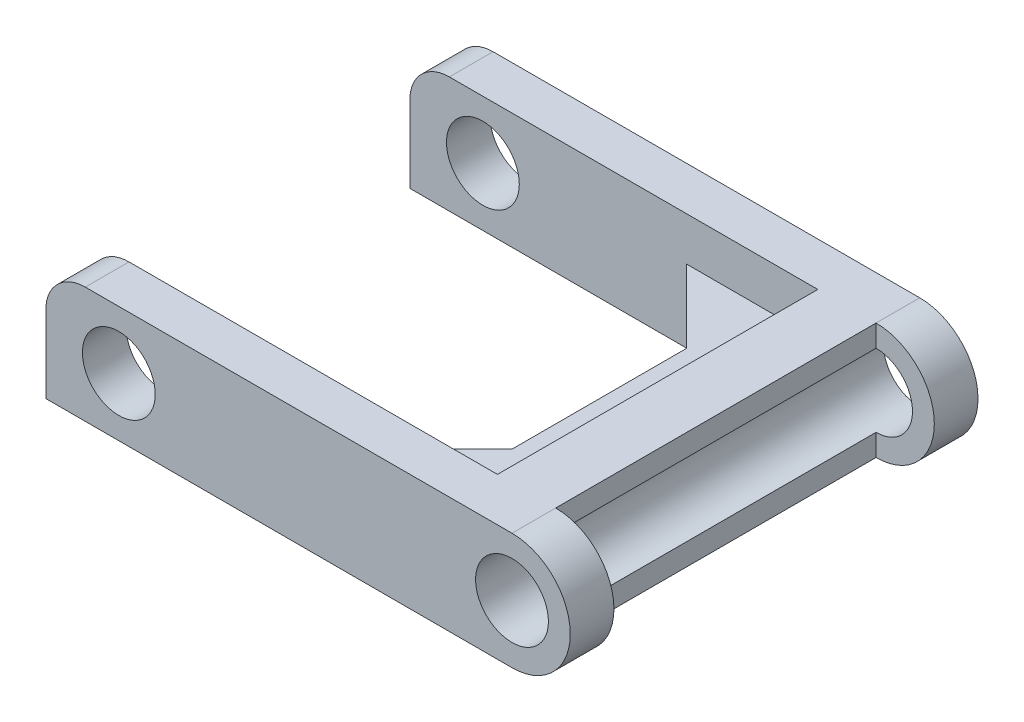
SolidWorks part; units mm, degrees
ref_plane "Front Plane" through (0, 0, 0) normal (0, 0, 1) x (1, 0, 0)
ref_plane "Top Plane" through (0, 0, 0) normal (0, 1, 0) x (1, 0, 0)
ref_plane "Right Plane" through (0, 0, 0) normal (1, 0, 0) x (0, 0, -1)
sketch "Sketch2" plane through (0, 0, 0) normal (0, 0, 1) x (1, 0, 0)
  line L0 (111.497, 39.8309) -> (96.847, 39.8234)
  line L1 (95.497, 38.3309) -> (95.497, 35.8309)
  line L2 (95.497, 35.8309) -> (111.497, 35.8309)
  arc A0 (96.847, 39.8234) -> (95.497, 38.3309) centre (96.8477, 38.466) ccw
  arc A1 (111.497, 35.8309) -> (111.497, 39.8309) centre (111.497, 37.8309) ccw
  circle A2 centre (97.997, 37.8309) radius 1.25
  circle A3 centre (111.497, 37.8309) radius 1.25
sketch "Sketch3" plane through (68.5686, 0, 0) normal (-1, 0, 0) x (0, 0, 1)
  line L0 (-10, 37.3309) -> (-10, 38.3309)
  line L1 (-10, 38.3309) -> (-12.5, 38.3309)
  line L2 (-12.5, 37.3309) -> (-10, 37.3309)
  line L3 (-4, 37.3309) -> (-4, 38.3309)
  line L4 (-1.5, 38.3309) -> (-4, 38.3309)
  line L5 (-4, 37.3309) -> (-1.5, 37.3309)
  line L6 (-4, 38.3309) -> (-10, 38.3309)
  line L7 (-10, 37.3309) -> (-4, 37.3309)
  line L8 (-12.5, 39.8309) -> (-1.5, 39.8309)
  line L9 (-14, 39.8309) -> (-12.5, 39.8309)
  line L10 (-12.5, 39.8309) -> (-12.5, 35.8309)
  line L11 (-12.5, 35.8309) -> (-14, 35.8309)
  line L12 (-14, 35.8309) -> (-14, 39.8309)
  line L13 (0, 35.8309) -> (-1.5, 35.8309)
  line L14 (-1.5, 35.8309) -> (-1.5, 39.8309)
  line L15 (-1.5, 39.8309) -> (0, 39.8309)
  line L16 (0, 39.8309) -> (0, 35.8309)
  line L17 (-12.5, 35.8309) -> (-1.5, 35.8309)
sketch "Sketch4" plane through (0, 55.3706, 0) normal (0, 1, 0) x (-1, 0, 0)
  line L0 (-104.997, -12.5) -> (-95.497, -12.5)
  line L1 (-95.497, -12.5) -> (-95.497, -14)
  line L2 (-95.497, -14) -> (-113.497, -14)
  line L3 (-113.497, -14) -> (-113.497, -12.5)
  line L4 (-113.497, -12.5) -> (-111.497, -12.5)
  line L5 (-111.497, -12.5) -> (-111.497, -1.5)
  line L6 (-111.497, -1.5) -> (-113.497, -1.5)
  line L7 (-113.497, -1.5) -> (-113.497, 0)
  line L8 (-113.497, 0) -> (-95.497, 0)
  line L9 (-95.497, 0) -> (-95.497, -1.5)
  line L10 (-95.497, -1.5) -> (-104.997, -1.5)
  line L11 (-104.997, -1.5) -> (-104.997, -12.5)
  line L12 (-104.997, -1.5) -> (-107.497, -4)
  line L13 (-107.497, -4) -> (-107.497, -10)
  line L14 (-107.497, -10) -> (-104.997, -12.5)
  line L15 (-104.997, -12.5) -> (-104.997, -1.5)
  line L16 (-104.997, -1.5) -> (-109.497, -1.5)
  line L17 (-109.497, -1.5) -> (-109.497, -12.5)
  line L18 (-109.497, -12.5) -> (-104.997, -12.5)
  line L19 (-104.997, -12.5) -> (-104.997, -1.5)
sketch "Sketch5" plane through (0, 0, 0) normal (0, 0, 1) x (1, 0, 0)
  line L0 (111.497, 39.8309) -> (96.847, 39.8234)
  line L1 (95.497, 38.3309) -> (95.497, 35.8309)
  line L2 (95.497, 35.8309) -> (111.497, 35.8309)
  arc A0 (96.847, 39.8234) -> (95.497, 38.3309) centre (96.8477, 38.466) ccw
  arc A1 (111.497, 35.8309) -> (111.497, 39.8309) centre (111.497, 37.8309) ccw
extrude "Extrude1" add sketch "Sketch5" against normal up to vertex (14 mm away)
sketch "Sketch6" plane through (0, 0, 0) normal (0, 0, 1) x (1, 0, 0)
  circle A0 centre (97.997, 37.8309) radius 1.25
  circle A1 centre (111.497, 37.8309) radius 1.25
extrude "Extrude2" cut sketch "Sketch6" against normal through all
sketch "Sketch7" plane through (0, 55.3706, 0) normal (0, 1, 0) x (-1, 0, 0)
  line L0 (-104.997, -12.5) -> (-95.497, -12.5)
  line L1 (-95.497, -12.5) -> (-95.497, -14)
  line L2 (-95.497, -14) -> (-113.497, -14)
  line L3 (-113.497, -14) -> (-113.497, -12.5)
  line L4 (-113.497, -12.5) -> (-111.497, -12.5)
  line L5 (-111.497, -12.5) -> (-111.497, -1.5)
  line L6 (-111.497, -1.5) -> (-113.497, -1.5)
  line L7 (-113.497, -1.5) -> (-113.497, 0)
  line L8 (-113.497, 0) -> (-95.497, 0)
  line L9 (-95.497, 0) -> (-95.497, -1.5)
  line L10 (-95.497, -1.5) -> (-104.997, -1.5)
  line L11 (-104.997, -1.5) -> (-109.497, -1.5)
  line L12 (-109.497, -1.5) -> (-109.497, -12.5)
  line L13 (-109.497, -12.5) -> (-104.997, -12.5)
extrude "Extrude3" cut sketch "Sketch7" against normal through all flip side to cut
sketch "Sketch8" plane through (0, 55.3706, 0) normal (0, 1, 0) x (-1, 0, 0)
  line L0 (-104.997, -1.5) -> (-107.497, -4)
  line L1 (-107.497, -4) -> (-107.497, -10)
  line L2 (-107.497, -10) -> (-104.997, -12.5)
  line L3 (-104.997, -1.5) -> (-109.497, -1.5)
  line L4 (-109.497, -1.5) -> (-109.497, -12.5)
  line L5 (-109.497, -12.5) -> (-104.997, -12.5)
extrude "Extrude4" add sketch "Sketch8" against normal up to vertex (18.0397 mm away) from vertex at -17.0397
